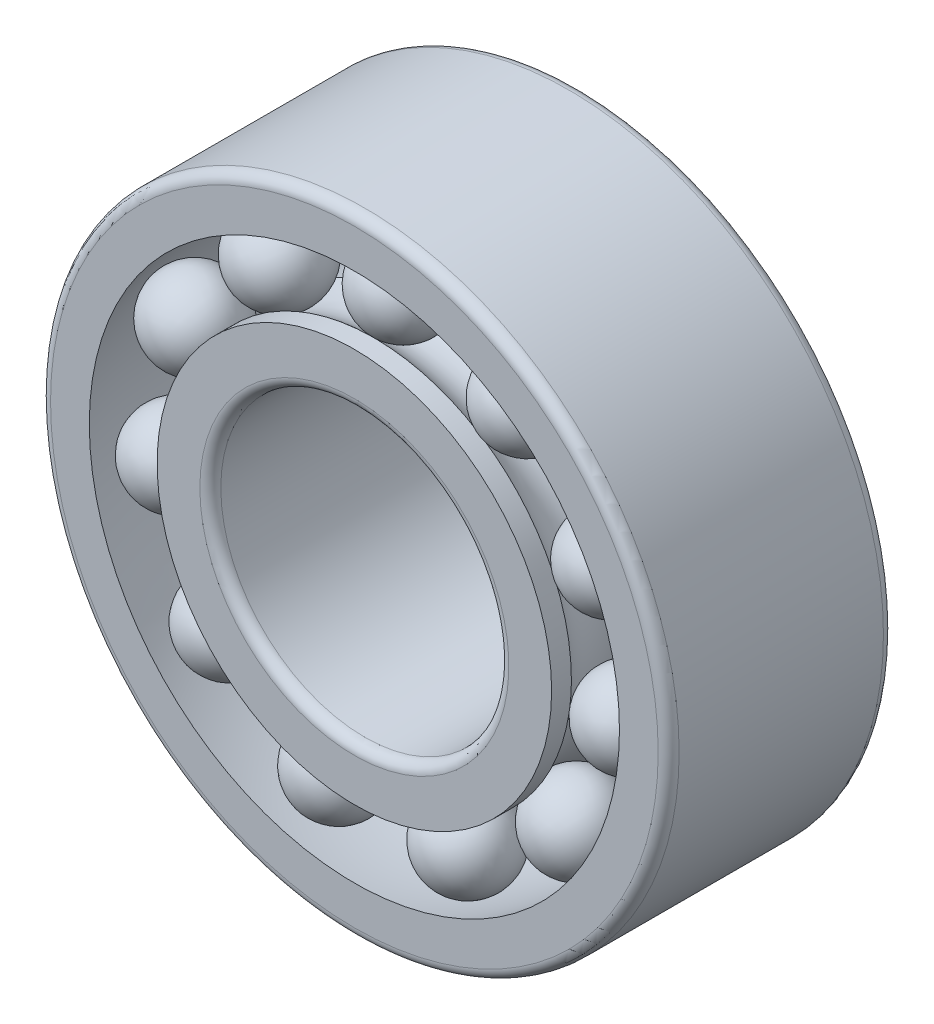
SolidWorks part; units mm, degrees
ref_plane "Front Plane" through (0, 0, 0) normal (0, 0, 1) x (1, 0, 0)
ref_plane "Top Plane" through (0, 0, 0) normal (0, 1, 0) x (1, 0, 0)
ref_plane "Right Plane" through (0, 0, 0) normal (1, 0, 0) x (0, 0, -1)
other "Configuration Table"
sketch "BaseSke" plane through (0, 0, 0) normal (1, 0, 0) x (0, 0, -1)
  line L0 (-47.2296, 0) -> (24.6132, 0) construction
  line L1 (-47.2296, 43.75) -> (24.6132, 43.75) construction
  line L2 (0, 129.5214) -> (0, -86.3012) construction
  line L3 (-12.1558, 52.0192) -> (-12.1558, 35.4808)
  line L4 (-21.5, 60) -> (21.5, 60) construction
  line L5 (-21.5, 27.5) -> (21.5, 27.5) construction
  line L6 (-21.5, 60) -> (-21.5, 27.5) construction
  line L7 (21.5, 60) -> (21.5, 27.5) construction
  line L8 (-20.425, 60) -> (-20.425, 27.5) construction
  arc A0 (-12.1558, 52.0192) -> (-12.1558, 35.4808) centre (-12.1558, 43.75) ccw
revolve "Ball" add sketch "BaseSke" angle 360 about L3
sketch "OuterRaceSke" plane through (0, 0, 0) normal (1, 0, 0) x (0, 0, -1)
  line L0 (0, 0) -> (0, 87.5396) construction
  line L1 (-21.5, 60) -> (21.5, 60)
  line L2 (-21.5, 60) -> (-21.5, 50.6063)
  line L4 (21.5, 60) -> (21.5, 50.6063)
  line L5 (-50.3916, 0) -> (55.2197, 0) construction
  arc A0 (-21.5, 50.6063) -> (21.5, 50.6063) centre (0, -57.2721) cw
  arc A1 (-21.5, 50.6267) -> (21.5, 50.6267) centre (0, -57.2721) cw construction
  arc A2 (-12.1558, 52.0192) -> (-12.1558, 35.4808) centre (-12.1558, 43.75) ccw construction
revolve "OuterRace" add sketch "OuterRaceSke" angle 360 about L5
mirror "MirrorBall" about plane through (0, 0, 0) normal (0, 0, 1) of "Ball"
sketch "InnerRaceSke" plane through (0, 0, 0) normal (1, 0, 0) x (0, 0, -1)
  line L0 (-70.8626, 0) -> (113.5527, 0) construction
  line L1 (0, 58.441) -> (0, -70.8113) construction
  line L2 (-21.5, 27.5) -> (21.5, 27.5)
  line L3 (-21.5, 27.5) -> (-21.5, 37.6562)
  line L4 (-21.5, 37.6562) -> (-17.7308, 37.6562)
  line L5 (21.5, 27.5) -> (21.5, 37.6563)
  line L6 (0, 129.5214) -> (0, -86.3012) construction
  line L7 (-6.5807, 37.6562) -> (6.5807, 37.6562)
  line L8 (21.5, 37.6563) -> (17.7308, 37.6562)
  arc A0 (-17.7308, 37.6562) -> (-6.5807, 37.6562) centre (-12.1558, 43.75) ccw
  circle A1 centre (-12.1558, 43.75) radius 8.2692 construction
  arc A2 (17.7308, 37.6562) -> (6.5807, 37.6562) centre (12.1558, 43.75) cw
  point P17 (0, 27.5)
  point P23 (0, 37.6562)
revolve "InnerRace" add sketch "InnerRaceSke" angle 360 about L0
fillet "Fillet1" radius 2 4 edges at (27.5, 0, -21.5) (27.5, 0, 21.5) (60, 0, -21.5) (60, 0, 21.5)
pattern_circular "CirPatternBall" count 11 over 360 about axis through (0, 0, 0) along (0, 0, 1) of "Ball", "MirrorBall"
sketch "TaperSke" plane through (0, 0, 0) normal (1, 0, 0) x (0, 0, -1)
  line L0 (-21.5, 27.5) -> (21.5, 27.5)
  line L1 (21.5, 27.5) -> (21.5, 31.0833)
  line L2 (21.5, 31.0833) -> (-21.5, 27.5)
  line L7 (-41.2502, 0) -> (40.8606, 0) construction
revolve "Taper" [suppressed] cut sketch "TaperSke" angle 360 about L7
fillet "Fillet2" [suppressed] radius 2
sketch "SimplifiedSke" plane through (0, 0, 0) normal (1, 0, 0) x (0, 0, -1)
  line L0 (37.5911, 0) -> (-37.5911, 0) construction
  line L1 (0, 0) -> (0, 72.9012) construction
  circle A0 centre (-12.1558, 43.75) radius 8.2692
  circle A1 centre (-12.1558, 43.75) radius 8.2692 construction
  circle A2 centre (12.1558, 43.75) radius 8.2692
revolve "Simplified" [suppressed] add sketch "SimplifiedSke" angle 360 about L0
equation "\"D1@BaseSke\" =  (\"Bearing_Outside_Diameter@BaseSke\"  +  \"Bearing_Inside_Diameter@BaseSke\"  )  / 4"
equation "\"Ball_diameter@BaseSke\" = \"Bearing_Thickness@BaseSke\" / 2.6"
equation "\"D2@BaseSke\" = \"Bearing_Thickness@BaseSke\"/40"
equation "\"D1@OuterRaceSke\" = \"Bearing_Inside_Diameter@BaseSke\"*2"
equation "\"D1@InnerRaceSke\" = \"Bearing_Inside_Diameter@BaseSke\" +  ( \"Bearing_Outside_Diameter@BaseSke\" - \"Bearing_Inside_Diameter@BaseSke\" )  / 3.2"
equation "\"D2@InnerRaceSke\" = \"Ball_diameter@BaseSke\"-0.02"
equation "\"D1@CirPatternBall\" = int( \"D1@BaseSke\"* pi  * 2 / \"Ball_diameter@BaseSke\" /1.4)"
equation "\"Taper@TaperSke\" = \"Bearing_Thickness@BaseSke\"/12"
equation "\"D1@Fillet2\" = \"Fillet_radius@Fillet1\""
